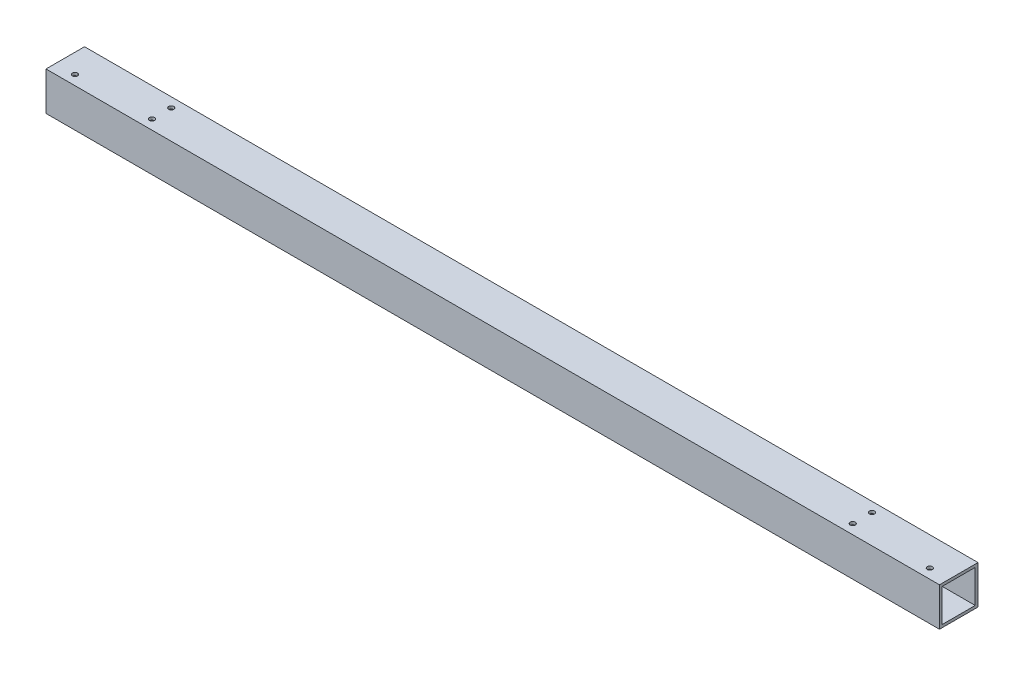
SolidWorks part; units mm, degrees
ref_plane "Front" through (0, 0, 0) normal (0, 0, 1) x (1, 0, 0)
ref_plane "Top" through (0, 0, 0) normal (0, 1, 0) x (1, 0, 0)
ref_plane "Right" through (0, 0, 0) normal (1, 0, 0) x (0, 0, -1)
sketch "Sketch1" plane through (0, 0, 0) normal (1, 0, 0) x (0, 0, -1)
  line L1 (0, 0) -> (50.8, 0)
  line L2 (0, 0) -> (0, 50.8)
  line L3 (0, 50.8) -> (50.8, 50.8)
  line L4 (50.8, 0) -> (50.8, 50.8)
  line L5 (3.6576, 47.1424) -> (47.1424, 47.1424)
  line L6 (3.6576, 47.1424) -> (3.6576, 3.6576)
  line L7 (3.6576, 3.6576) -> (47.1424, 3.6576)
  line L8 (47.1424, 47.1424) -> (47.1424, 3.6576)
  dimension "D1" = 50.8
  dimension "D2" = 50.8
  dimension "D3" = 3.6576
  dimension "D4" = 3.6576
  dimension "D5" = 3.6576
  dimension "D6" = 3.6576
extrude "Extrude1" add sketch "Sketch1" along normal blind 3048
sketch "Sketch3" plane through (0, 0, -50.8) normal (0, 0, -1) x (-1, 0, 0)
  line L5 (0, 0) -> (0, -664.0913) construction
  line L6 (0, -664.0913) -> (-3047.8384, -664.0913) construction
  line L7 (-3047.8384, 0) -> (-3047.8384, -664.0913) construction
  line L8 (-1523.9192, -664.0913) -> (-1523.9192, 171.6838) construction
  circle A0 centre (-95.6188, 12.3324) radius 3.3731
  circle A1 centre (-57.6849, 37.9799) radius 3.3731
  circle A2 centre (-3028.95, 12.7) radius 3.3731
  circle A4 centre (-19.4204, 12.8284) radius 3.3731
  circle A5 centre (-2952.2196, 12.3324) radius 3.3731
  circle A6 centre (-2990.85, 38.1) radius 3.3731
  point P0 (-3047.8384, 0)
extrude "Cut-Extrude2" [suppressed] cut sketch "Sketch3" against normal through all
sketch "Sketch4" plane through (0, 0, -50.8) normal (0, 0, -1) x (-1, 0, 0)
  circle A0 centre (-2235.1466, 25.4) radius 3.3731
  circle A1 centre (-2298.6466, 25.4) radius 3.3731
  circle A2 centre (-2362.1466, 25.4) radius 3.3731
  circle A3 centre (-812.7466, 25.4) radius 3.3731
  circle A4 centre (-749.2466, 25.4) radius 3.3731
  circle A5 centre (-685.7466, 25.4) radius 3.3731
  dimension "D1" = 6.7462
extrude "Cut-Extrude3" [suppressed] cut sketch "Sketch4" against normal through all
sketch "Sketch5" plane through (0, 0, -50.8) normal (0, 0, -1) x (-1, 0, 0)
  circle A0 centre (-1536.7, 38.1) radius 3.3731
  circle A1 centre (-1511.2466, 12.7) radius 3.3731
  dimension "D1" = 6.7462
sketch "Sketch6" plane through (0, 0, -50.8) normal (0, 0, -1) x (-1, 0, 0)
  circle A0 centre (-1524.0534, 25.4) radius 3.3731
  circle A1 centre (-1460.5534, 25.4) radius 3.3731
  circle A2 centre (-1587.5534, 25.4) radius 3.3731
  circle A3 centre (-736.6534, 12.7) radius 3.3731
  circle A4 centre (-762.0534, 38.1) radius 3.3731
  circle A5 centre (-2311.4534, 38.1) radius 3.3731
  circle A6 centre (-2286.0534, 12.7) radius 3.3731
  dimension "D1" = 6.7462
  dimension "D2" = 6.7462
  dimension "D3" = 6.7462
extrude "Cut-Extrude4" [suppressed] cut sketch "Sketch6" against normal through all
sketch "Sketch7" plane through (0, 0, -50.8) normal (0, 0, -1) x (-1, 0, 0)
  circle A0 centre (-1536.7, 38.1) radius 3.3731
  circle A1 centre (-1511.2466, 12.7) radius 3.3731
  dimension "D1" = 6.7462
  dimension "D2" = 6.7462
extrude "Cut-Extrude5" [suppressed] cut sketch "Sketch7" against normal through all
sketch "Sketch8" plane through (0, 0, 0) normal (0, 0, 1) x (1, 0, 0)
  line L0 (1524, 50.8) -> (1524, 207.5111) construction
  line L1 (3048, 50.8) -> (0, 50.8) construction
  circle A0 centre (95.25, 12.7) radius 3.304
  circle A1 centre (57.15, 38.1) radius 3.1902
  circle A2 centre (19.05, 12.7) radius 3.304
  circle A3 centre (3028.95, 12.7) radius 3.304
  circle A4 centre (2990.85, 38.1) radius 3.1902
  circle A5 centre (2952.75, 12.7) radius 3.304
extrude "Cut-Extrude6" [suppressed] cut sketch "Sketch8" against normal through all
sketch "Sketch9" plane through (0, 0, -50.8) normal (0, 0, -1) x (-1, 0, 0)
  circle A0 centre (-44.45, 38.1) radius 3.3731
  circle A1 centre (-3003.55, 12.7) radius 3.3731
  circle A2 centre (-3028.95, 38.1) radius 3.3731
  dimension "D1" = 6.7462
  dimension "D2" = 6.7462
extrude "Cut-Extrude7" [suppressed] cut sketch "Sketch9" against normal through all
sketch "Sketch10" plane through (0, 0, 0) normal (0, 0, 1) x (1, 0, 0)
  line L1 (3139.7884, 166.4746) -> (1177.798, 166.4746)
  line L2 (3139.7884, 166.4746) -> (3139.7884, -140.6406)
  line L3 (3139.7884, -140.6406) -> (1177.798, -140.6406)
  line L4 (1177.798, 166.4746) -> (1177.798, -140.6406)
  dimension "D1" = 1177.798
extrude "Extrude2" cut sketch "Sketch10" against normal through all
sketch "Sketch11" plane through (0, 0, 0) normal (0, -1, 0) x (1, 0, 0)
  line L0 (588.899, 0) -> (588.899, 91.6844) construction
  line L1 (1177.798, 0) -> (0, 0) construction
  circle A0 centre (1050.798, -12.7) radius 3.3731
  circle A1 centre (1050.798, -38.1) radius 3.3731
  circle A2 centre (1152.398, -12.7) radius 3.3731
  circle A3 centre (25.4, -12.7) radius 3.3731
  circle A4 centre (127, -38.1) radius 3.3731
  circle A5 centre (127, -12.7) radius 3.3731
  dimension "D1" = 6.7462
extrude "Cut-Extrude8" cut sketch "Sketch11" against normal through all
